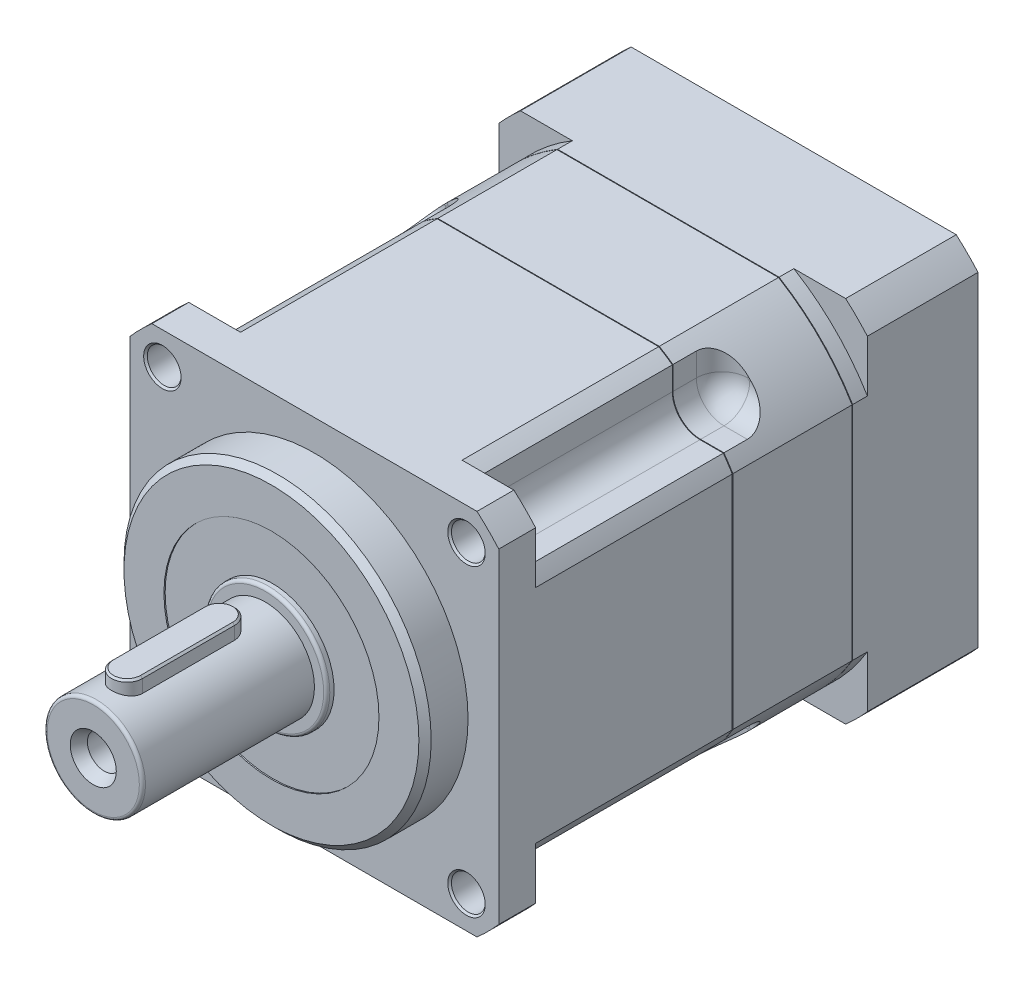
SolidWorks part; units mm, degrees
ref_plane "前视基准面" through (0, 0, 0) normal (0, 0, 1) x (1, 0, 0)
ref_plane "上视基准面" through (0, 0, 0) normal (0, 1, 0) x (1, 0, 0)
ref_plane "右视基准面" through (0, 0, 0) normal (1, 0, 0) x (0, 0, -1)
sketch "草图1" plane through (0, 0, 0) normal (0, 0, 1) x (1, 0, 0)
  line L1 (-26.4575, 30) -> (26.4575, 30)
  line L2 (-30, 26.4575) -> (-30, -26.4575)
  line L3 (-26.4575, -30) -> (26.4575, -30)
  line L4 (30, 26.4575) -> (30, -26.4575)
  arc A0 (-26.4575, 30) -> (-30, 26.4575) centre (0, 0) ccw
  arc A1 (-30, -26.4575) -> (-26.4575, -30) centre (0, 0) ccw
  arc A2 (26.4575, -30) -> (30, -26.4575) centre (0, 0) ccw
  arc A3 (30, 26.4575) -> (26.4575, 30) centre (0, 0) ccw
  dimension "D1" = 30
  dimension "D4" = 30
extrude "凸台-拉伸1" add sketch "草图1" along normal blind 6
sketch "草图2" plane through (0, 0, 6) normal (0, 0, 1) x (1, 0, 0)
  circle A0 centre (0, 0) radius 25
extrude "凸台-拉伸2" add sketch "草图2" along normal blind 7
sketch "草图3" plane through (0, 0, 0) normal (0, 0, -1) x (-1, 0, 0)
  line L1 (-18.0278, 30) -> (18.0278, 30)
  line L2 (-30, 18.0278) -> (-30, -18.0278)
  line L3 (-18.0278, -30) -> (18.0278, -30)
  line L4 (30, 18.0278) -> (30, -18.0278)
  arc A0 (-18.0278, 30) -> (-30, 18.0278) centre (0, 0) ccw
  arc A1 (-30, -18.0278) -> (-18.0278, -30) centre (0, 0) ccw
  arc A2 (18.0278, -30) -> (30, -18.0278) centre (0, 0) ccw
  arc A3 (30, 18.0278) -> (18.0278, 30) centre (0, 0) ccw
  dimension "D1" = 30
  dimension "D3" = 30
extrude "凸台-拉伸3" add sketch "草图3" along normal blind 32
sketch "草图4" plane through (0, 0, -32) normal (0, 0, -1) x (-1, 0, 0)
  line L1 (-34.1586, 33.3913) -> (-20.25, 33.3913)
  line L2 (-34.1586, 33.3913) -> (-34.1586, 20.25)
  line L3 (-34.1586, 20.25) -> (-20.25, 20.25)
  line L4 (-20.25, 33.3913) -> (-20.25, 20.25)
  dimension "D1" = 20.25
  dimension "D2" = 20.25
extrude "切除-拉伸1" cut sketch "草图4" against normal up to surface (32 mm away)
pattern_circular "阵列(圆周)1" count 4 over 360 about axis through (0, 0, 0) along (0, 0, 1) of "切除-拉伸1"
fillet "圆角1" radius 4.5 4 edges at (20.25, -20.25, -16) (-20.25, -20.25, -16) (-20.25, 20.25, -16) (20.25, 20.25, -16)
sketch "草图5" plane through (0, 0, 6) normal (0, 0, 1) x (1, 0, 0)
  line L0 (0, 0) -> (-28.2843, 28.2843) construction
  circle A0 centre (0, 0) radius 35 construction
  arc A1 (-26.4575, 30) -> (-30, 26.4575) centre (0, 0) ccw construction
  circle A2 centre (-24.7487, 24.7487) radius 2.75
extrude "切除-拉伸2" cut sketch "草图5" against normal blind 32
pattern_circular "阵列(圆周)2" count 4 over 360 about axis through (0, 0, 0) along (0, 0, 1) of "切除-拉伸2"
ref_plane "基准面1" through (0, 0, -32.1) normal (0, 0, -1) x (-1, 0, 0)
sketch "草图6" plane through (0, 0, -32.1) normal (0, 0, -1) x (-1, 0, 0)
  line L1 (-18.0278, 30) -> (18.0278, 30)
  line L2 (-30, 18.0278) -> (-30, -18.0278)
  line L3 (-18.0278, -30) -> (18.0278, -30)
  line L4 (30, 18.0278) -> (30, -18.0278)
  arc A0 (-18.0278, 30) -> (-30, 18.0278) centre (0, 0) ccw
  arc A1 (-30, -18.0278) -> (-18.0278, -30) centre (0, 0) ccw
  arc A2 (18.0278, -30) -> (30, -18.0278) centre (0, 0) ccw
  arc A3 (30, 18.0278) -> (18.0278, 30) centre (0, 0) ccw
  dimension "D1" = 30
  dimension "D3" = 30
extrude "凸台-拉伸4" add sketch "草图6" along normal blind 19.4 separate body
sketch "草图7" plane through (0, 0, -32.1) normal (0, 0, 1) x (1, 0, 0)
  line L1 (-36.173, 34.5423) -> (-20.25, 34.5423)
  line L2 (-36.173, 34.5423) -> (-36.173, 20.25)
  line L3 (-36.173, 20.25) -> (-20.25, 20.25)
  line L4 (-20.25, 34.5423) -> (-20.25, 20.25)
  dimension "D1" = 20.25
  dimension "D2" = 20.25
extrude "切除-拉伸3" cut sketch "草图7" against normal blind 8
pattern_circular "阵列(圆周)3" count 4 over 360 about axis through (0, 0, 0) along (0, 0, 1) of "切除-拉伸3"
fillet "圆角2" radius 4.5 4 edges at (-20.25, -20.25, -36.1) (20.25, -20.25, -36.1) (20.25, 20.25, -36.1) (-20.25, 20.25, -36.1)
fillet "圆角3" radius 4.2 12 edges at (20.25, 26.6486, -40.1) (26.6486, 20.25, -40.1) (-26.6486, 20.25, -40.1) (-20.25, 26.6486, -40.1) (-20.25, -26.6486, -40.1) (-26.6486, -20.25, -40.1) (26.6486, -20.25, -40.1) (20.25, -26.6486, -40.1) (21.568, 21.568, -40.1) (-21.568, 21.568, -40.1) (-21.568, -21.568, -40.1) (21.568, -21.568, -40.1)
chamfer "倒角1" distance 1 angle 45 1 edges at (25, 0, 13)
ref_plane "基准面2" through (0, 0, -51.6) normal (0, 0, -1) x (-1, 0, 0)
sketch "草图8" plane through (0, 0, -51.6) normal (0, 0, -1) x (-1, 0, 0)
  line L0 (18.0278, 30) -> (-18.0278, 30) construction
  line L1 (-30, 18.0278) -> (-30, -18.0278) construction
  line L2 (-18.0278, -30) -> (18.0278, -30) construction
  line L3 (30, -18.0278) -> (30, 18.0278) construction
  line L4 (18.0278, 30) -> (-18.0278, 30)
  line L5 (-30, 18.0278) -> (-30, -18.0278)
  line L6 (-18.0278, -30) -> (18.0278, -30)
  line L7 (30, -18.0278) -> (30, 18.0278)
  arc A0 (30, 18.0278) -> (18.0278, 30) centre (0, 0) ccw construction
  arc A1 (-18.0278, 30) -> (-30, 18.0278) centre (0, 0) ccw construction
  arc A2 (-30, -18.0278) -> (-18.0278, -30) centre (0, 0) ccw construction
  arc A3 (18.0278, -30) -> (30, -18.0278) centre (0, 0) ccw construction
  arc A4 (30, 18.0278) -> (18.0278, 30) centre (0, 0) ccw
  arc A5 (-18.0278, 30) -> (-30, 18.0278) centre (0, 0) ccw
  arc A6 (-30, -18.0278) -> (-18.0278, -30) centre (0, 0) ccw
  arc A7 (18.0278, -30) -> (30, -18.0278) centre (0, 0) ccw
extrude "凸台-拉伸5" add sketch "草图8" along normal blind 2.4 separate body
sketch "草图9" plane through (0, 0, -54) normal (0, 0, -1) x (-1, 0, 0)
  line L1 (-26.4575, 30) -> (26.4575, 30)
  line L2 (-30, 26.4575) -> (-30, -26.4575)
  line L3 (-26.4575, -30) -> (26.4575, -30)
  line L4 (30, 26.4575) -> (30, -26.4575)
  arc A0 (-26.4575, 30) -> (-30, 26.4575) centre (0, 0) ccw
  arc A1 (-30, -26.4575) -> (-26.4575, -30) centre (0, 0) ccw
  arc A2 (26.4575, -30) -> (30, -26.4575) centre (0, 0) ccw
  arc A3 (30, 26.4575) -> (26.4575, 30) centre (0, 0) ccw
  dimension "D1" = 30
  dimension "D3" = 30
extrude "凸台-拉伸6" add sketch "草图9" along normal blind 18
sketch "草图10" plane through (0, 0, -72) normal (0, 0, -1) x (-1, 0, 0)
  circle A0 centre (0, 0) radius 25
extrude "切除-拉伸4" cut sketch "草图10" against normal blind 5
sketch "草图11" plane through (0, 0, -72) normal (0, 0, -1) x (-1, 0, 0)
  line L0 (0, 0) -> (0, -25) construction
  line L1 (0, 0) -> (6.4705, -24.1481)
  circle A0 centre (0, 0) radius 25 construction
  circle A1 centre (6.4705, -24.1481) radius 4
  dimension "D1" = 15
extrude "切除-拉伸5" cut sketch "草图11" against normal blind 12 contours A1
pattern_circular "阵列(圆周)4" count 4 over 360 about axis through (0, 0, 0) along (0, 0, 1) of "切除-拉伸5"
sketch "草图12" plane through (0, 0, -72) normal (0, 0, -1) x (-1, 0, 0)
  line L0 (0, 0) -> (-24.1481, -6.4705) construction
  line L1 (0, 0) -> (-15.733, -19.4286) construction
  arc A0 (-22.8071, -10.239) -> (2.5363, -24.871) centre (0, 0) ccw construction
  circle A1 centre (-15.733, -19.4286) radius 4
  dimension "D1" = 36
extrude "切除-拉伸6" cut sketch "草图12" against normal blind 12
pattern_circular "阵列(圆周)5" count 2 over 360 about axis through (0, 0, 0) along (0, 0, 1) of "切除-拉伸6"
sketch "草图13" plane through (0, 0, -67) normal (0, 0, -1) x (-1, 0, 0)
  circle A0 centre (0, 0) radius 19
extrude "切除-拉伸7" cut sketch "草图13" against normal blind 13
sketch "草图14" plane through (0, 0, -60) normal (0, 0, -1) x (-1, 0, 0)
  line L1 (-5.6437, 25.789) -> (-7.4781, 25.6846)
  line L2 (-7.4781, 25.6846) -> (-8.3049, 24.0438)
  line L3 (-8.3049, 24.0438) -> (-7.2973, 22.5073)
  line L4 (-7.2973, 22.5073) -> (-5.4629, 22.6117)
  line L5 (-5.4629, 22.6117) -> (-4.6361, 24.2525)
  line L6 (-4.6361, 24.2525) -> (-5.6437, 25.789)
  circle A0 centre (-6.4705, 24.1481) radius 3
  circle A1 centre (-6.4705, 24.1481) radius 1.5912 construction
extrude "凸台-拉伸7" add sketch "草图14" along normal blind 6
pattern_circular "阵列(圆周)6" count 4 over 360 about axis through (0, 0, 0) along (0, 0, 1) of "凸台-拉伸7"
sketch "草图15" plane through (0, 0, -60) normal (0, 0, -1) x (-1, 0, 0)
  line L1 (-14.8157, -17.8764) -> (-16.6186, -17.8581)
  line L2 (-16.6186, -17.8581) -> (-17.5359, -19.4103)
  line L3 (-17.5359, -19.4103) -> (-16.6503, -20.9809)
  line L4 (-16.6503, -20.9809) -> (-14.8474, -20.9992)
  line L5 (-14.8474, -20.9992) -> (-13.9301, -19.447)
  line L6 (-13.9301, -19.447) -> (-14.8157, -17.8764)
  circle A0 centre (-15.733, -19.4286) radius 3
  circle A1 centre (-15.733, -19.4286) radius 1.5615 construction
extrude "凸台-拉伸8" add sketch "草图15" along normal blind 6
pattern_circular "阵列(圆周)7" count 2 over 360 about axis through (0, 0, 0) along (0, 0, 1) of "凸台-拉伸8"
sketch "草图16" plane through (0, 0, -72) normal (0, 0, -1) x (-1, 0, 0)
  line L0 (0, 0) -> (-24.7487, 24.7487)
  circle A0 centre (0, 0) radius 35
hole_wizard "M4 螺纹孔1" positions "3D草图1" profile "草图17" tap size "M4" standard "GB"
sketch3d "3D草图1"
  point P0 (24.7487, 24.7487, -72)
sketch "草图17" plane through (24.7487, 24.7487, -72) normal (1, 0, 0) x (0, 1, 0)
  line L0 (0, 0) -> (0, 16.4914)
  line L1 (0, 16.4914) -> (1.65, 15.5)
  line L2 (1.65, 15.5) -> (1.65, 0)
  line L5 (1.65, 0) -> (0, 0)
  line L10 (0, 16.4914) -> (-1.65, 15.5) construction
  line L11 (0, -6.35) -> (0, 107.95) construction
  dimension "螺纹孔钻头直径" = 3.3
  dimension "螺纹孔钻头深度" = 15.5
  dimension "导头角度" = 118
pattern_circular "阵列(圆周)8" count 4 over 360 about axis through (0, 0, 0) along (0, 0, 1) of "M4 螺纹孔1"
sketch "草图18" plane through (0, 0, -54) normal (0, 0, -1) x (-1, 0, 0)
  circle A0 centre (0, 0) radius 16.5
extrude "凸台-拉伸9" add sketch "草图18" along normal blind 11.5
chamfer "倒角2" distance 1 angle 45 1 edges at (-16.5, 0, -65.5)
sketch "草图19" plane through (0, 0, -72) normal (0, 0, -1) x (-1, 0, 0)
  circle A0 centre (0, 0) radius 7
extrude "切除-拉伸8" cut sketch "草图19" against normal blind 34
sketch "草图20" plane through (0, 0, -65.5) normal (0, 0, -1) x (-1, 0, 0)
  line L1 (-17.4577, 0.5) -> (18.2251, 0.5)
  line L2 (-17.4577, 0.5) -> (-17.4577, -0.5)
  line L3 (-17.4577, -0.5) -> (18.2251, -0.5)
  line L4 (18.2251, 0.5) -> (18.2251, -0.5)
  dimension "D1" = 0.5
  dimension "D2" = 1
extrude "切除-拉伸9" cut sketch "草图20" against normal up to surface (11.5 mm away)
sketch "草图21" plane through (0, 0, 13) normal (0, 0, 1) x (1, 0, 0)
  circle A0 centre (0, 0) radius 8
extrude "凸台-拉伸10" add sketch "草图21" along normal blind 29
sketch "草图22" plane through (0, 0, 13) normal (0, 0, 1) x (1, 0, 0)
  circle A0 centre (0, 0) radius 10
extrude "凸台-拉伸11" add sketch "草图22" along normal blind 1
fillet "圆角4" radius 0.5 1 edges at (10, 0, 14)
fillet "圆角5" radius 0.5 1 edges at (8, 0, 42)
sketch "草图23" plane through (0, 0, 13) normal (0, 0, 1) x (1, 0, 0)
  circle A0 centre (0, 0) radius 17.5
  circle A1 centre (0, 0) radius 10
extrude "切除-拉伸10" cut sketch "草图23" against normal blind 0.2
sketch "草图24" plane through (0, 0, 0) normal (0, 1, 0) x (1, 0, 0)
  line L1 (-7.5, -42) -> (7.5, -42) construction
  line L2 (-2.5, -21.5) -> (-2.5, -36.5)
  line L3 (2.5, -21.5) -> (2.5, -36.5)
  arc A0 (-2.5, -36.5) -> (2.5, -36.5) centre (0, -36.5) ccw
  arc A1 (2.5, -21.5) -> (-2.5, -21.5) centre (0, -21.5) ccw
  dimension "D1" = 15
  dimension "D2" = 5.5
extrude "凸台-拉伸12" add sketch "草图24" along normal blind 10
chamfer "倒角3" distance 0.3 angle 45 8 edges at (-24.7487, -21.9987, 6) (21.9987, -24.7487, 6) (24.7487, 21.9987, 6) (-21.9987, 24.7487, 6) (-2.5, 10, 29) (0, 10, 39) (0, 10, 19) (2.5, 10, 29)
sketch "草图25" plane through (0, 0, 42) normal (0, 0, 1) x (1, 0, 0)
  circle A0 centre (0, 0) radius 2.75
extrude "切除-拉伸11" cut sketch "草图25" against normal blind 4.8
sketch "草图26" plane through (0, 0, 42) normal (0, 0, 1) x (1, 0, 0)
  circle A0 centre (0, 0) radius 3.75
ref_plane "基准面3" through (0, 0, 40.2) normal (0, 0, 1) x (1, 0, 0)
sketch "草图27" plane through (0, 0, 40.2) normal (0, 0, 1) x (1, 0, 0)
  circle A0 centre (0, 0) radius 2.75 construction
  circle A1 centre (0, 0) radius 2.75
loft "切除-放样1" cut profiles "草图26", "草图27"
hole_wizard "M5 螺纹孔1" positions "3D草图2" profile "草图28" tap size "M5" standard "GB"
sketch3d "3D草图2"
  line L0 (0, 0, 37.2) -> (0, 0, 40.2) construction
  point P0 (0, 0, 37.2)
sketch "草图28" plane through (0, 0, 37.2) normal (1, 0, 0) x (0, -1, 0)
  line L0 (0, 0) -> (0, 20.4618)
  line L1 (0, 20.4618) -> (2.1, 19.2)
  line L2 (2.1, 19.2) -> (2.1, 0)
  line L5 (2.1, 0) -> (0, 0)
  line L10 (0, 20.4618) -> (-2.1, 19.2) construction
  line L11 (0, -6.35) -> (0, 107.95) construction
  dimension "螺纹孔钻头直径" = 4.2
  dimension "螺纹孔钻头深度" = 19.2
  dimension "导头角度" = 118
